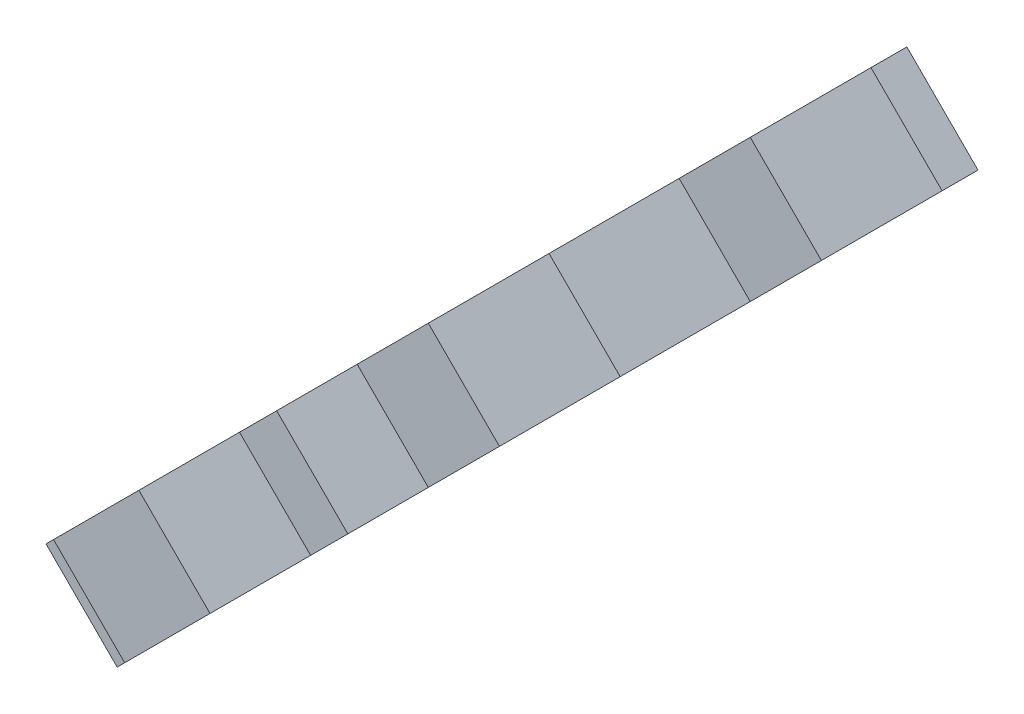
SolidWorks part; units mm, degrees
ref_plane "Front Plane" through (0, 0, 0) normal (0, 0, 1) x (1, 0, 0)
ref_plane "Top Plane" through (0, 0, 0) normal (0, 1, 0) x (1, 0, 0)
ref_plane "Right Plane" through (0, 0, 0) normal (1, 0, 0) x (0, 0, -1)
sketch "Sketch6" plane through (0, 0, 0) normal (0, 0, 1) x (1, 0, 0)
  line L0 (0, 0) -> (38.1, 0) construction
  line L1 (38.1, 0) -> (38.1, 38.1) construction
  line L2 (38.1, 38.1) -> (0, 0) construction
  dimension "D1" = 38.1
  dimension "D2" = 38.1
sketch "Sketch7" plane through (0, 0, 0) normal (1, 0, 0) x (0, 0, -1)
  line L0 (0, 0) -> (-38.1, 0) construction
  dimension "D1" = 38.1
ref_plane "Plane2" through (0, 0, 0) normal (-0.7071, 0.7071, 0) x (0.7071, 0.7071, 0)
sketch "Sketch8" plane through (0, 0, 0) normal (-0.7071, 0.7071, 0) x (0.7071, 0.7071, 0)
  line L0 (0, 0) -> (26.9408, 0)
  line L1 (26.9408, 0) -> (26.9408, 43.815)
  line L2 (0, 0) -> (0, 26.67)
  line L5 (26.9408, 43.815) -> (0, 26.67)
  dimension "D1" = 26.9408
  dimension "D2" = 43.815
  dimension "D3" = 26.67
extrude "Boss-Extrude1" add sketch "Sketch8" along normal blind 6.35
ref_plane "Plane3" through (-4.4901, 0, 0) normal (-1, 0, 0) x (0, 0, 1)
sketch "Sketch12" plane through (-4.4901, 4.4901, 0) normal (-0.7071, 0.7071, 0) x (0, 0, 1)
  line L0 (0, 26.9408) -> (-43.815, 26.9408) construction
  line L1 (-43.815, 26.9408) -> (-33.02, 26.9408)
  line L2 (-43.815, 26.9408) -> (-43.815, 20.5908)
  line L3 (-43.815, 20.5908) -> (-33.02, 20.5908)
  line L4 (-33.02, 26.9408) -> (-33.02, 20.5908)
  line L5 (-25.4, 26.9408) -> (-12.7, 26.9408)
  line L6 (-25.4, 26.9408) -> (-25.4, 20.5908)
  line L7 (-25.4, 20.5908) -> (-12.7, 20.5908)
  line L8 (-12.7, 26.9408) -> (-12.7, 20.5908)
  line L9 (-26.67, 0) -> (0, 0) construction
  line L14 (0, 26.9408) -> (-5.08, 26.9408)
  line L15 (0, 26.9408) -> (0, 20.5908)
  line L16 (0, 20.5908) -> (-5.08, 20.5908)
  line L17 (-5.08, 26.9408) -> (-5.08, 20.5908)
  line L18 (-10.16, 0) -> (-20.32, 0)
  line L19 (-10.16, 0) -> (-10.16, 8.9662)
  line L20 (-10.16, 8.9662) -> (-20.32, 8.9662)
  line L21 (-20.32, 0) -> (-20.32, 8.9662)
  line L22 (0, 0) -> (0, 26.9408) construction
  point P15 (-5.08, 23.7658)
  dimension "D1" = 6.35
  dimension "D2" = 6.35
  dimension "D3" = 6.35
  dimension "D4" = 5.08
  dimension "D5" = 7.62
  dimension "D6" = 12.7
  dimension "D7" = 7.62
  dimension "D8" = 8.9662
  dimension "D9" = 10.16
  dimension "D10" = 10.16
sketch "Sketch13" plane through (0, 0, 0) normal (0, 0, 1) x (1, 0, 0)
  line L0 (2.3349, 11.3151) -> (6.825, 6.825)
  line L1 (2.3349, 11.3151) -> (7.723, 16.7033)
  line L2 (6.825, 6.825) -> (12.2131, 12.2131)
  line L3 (7.723, 16.7033) -> (12.2131, 12.2131)
  line L4 (-4.4901, 4.4901) -> (14.5599, 23.5401) construction
  line L5 (0, 0) -> (19.05, 19.05) construction
  line L6 (-4.4901, 4.4901) -> (0, 0) construction
  dimension "D1" = 9.652
  dimension "D2" = 7.62
extrude "Boss-Extrude3" add sketch "Sketch13" along normal blind 6.35
extrude "Cut-Extrude2" cut sketch "Sketch12" against normal blind 15.24
